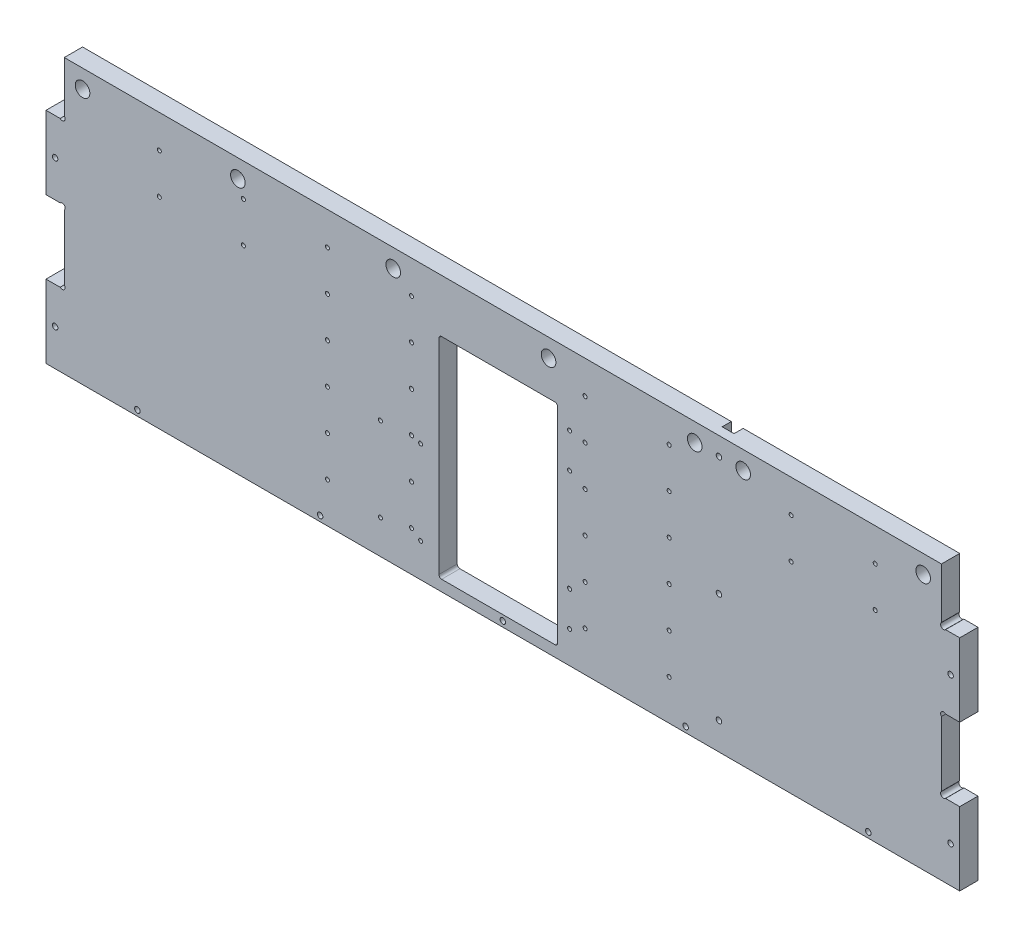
SolidWorks part; units mm, degrees
ref_plane "Plan de face" through (0, 0, 0) normal (0, 0, 1) x (1, 0, 0)
ref_plane "Plan de dessus" through (0, 0, 0) normal (0, 1, 0) x (1, 0, 0)
ref_plane "Plan de droite" through (0, 0, 0) normal (1, 0, 0) x (0, 0, -1)
sketch "Esquisse1" plane through (0, 0, 0) normal (0, 0, 1) x (1, 0, 0)
  line L0 (0, 0) -> (500, 0)
  line L2 (275, 0) -> (-275, 0) construction
  line L4 (0, -82.5) -> (0, 82.5) construction
  line L5 (500, 0) -> (500, 40)
  line L6 (500, 40) -> (490, 40)
  line L7 (490, 40) -> (490, 80)
  line L8 (490, 80) -> (500, 80)
  line L9 (500, 80) -> (500, 120)
  line L10 (500, 120) -> (490, 120)
  line L11 (490, 120) -> (490, 150)
  line L12 (490, 150) -> (10, 150)
  line L13 (10, 150) -> (10, 120)
  line L14 (10, 120) -> (0, 120)
  line L15 (0, 120) -> (0, 80)
  line L16 (0, 80) -> (10, 80)
  line L17 (10, 80) -> (10, 40)
  line L18 (10, 40) -> (0, 40)
  line L19 (0, 40) -> (0, 0)
  dimension "D1" = 40
  dimension "D2" = 10
  dimension "D3" = 500
  dimension "D4" = 150
extrude "Extrusion1" add sketch "Esquisse1" along normal blind 10
sketch "Esquisse2" plane through (0, 0, 10) normal (0, 0, 1) x (1, 0, 0)
  line L0 (250, 0) -> (250, 150) construction
  line L1 (0, 0) -> (500, 0) construction
  line L2 (490, 150) -> (10, 150) construction
  line L3 (10, 40) -> (-2.4055, 52.4055) construction
  line L4 (10, 40) -> (0, 40) construction
  line L5 (10, 80) -> (10, 40) construction
  line L6 (10, 80) -> (-2.4762, 67.5238) construction
  line L7 (0, 80) -> (10, 80) construction
  line L8 (10, 120) -> (-2.4762, 132.4762) construction
  line L9 (10, 120) -> (0, 120) construction
  line L10 (10, 150) -> (10, 120) construction
  line L11 (490, 40) -> (495.9282, 45.9282) construction
  line L12 (500, 40) -> (490, 40) construction
  circle A0 centre (8.8686, 121.1314) radius 1.6
  circle A1 centre (8.8686, 78.8686) radius 1.6
  circle A2 centre (8.8686, 41.1314) radius 1.6
  circle A3 centre (491.1314, 121.1314) radius 1.6
  circle A4 centre (491.1314, 78.8686) radius 1.6
  circle A5 centre (491.1314, 41.1314) radius 1.6
  dimension "D1" = 3.2
extrude "Enlèv. mat.-enfourchement" cut sketch "Esquisse2" against normal through all
sketch "Esquisse3" plane through (0, 0, 10) normal (0, 0, 1) x (1, 0, 0)
  line L0 (500, 3) -> (0, 3) construction
  line L3 (500, 0) -> (500, 40) construction
  line L4 (250, 0) -> (250, 150) construction
  line L5 (0, 0) -> (500, 0) construction
  line L6 (490, 150) -> (10, 150) construction
  line L7 (495, 120) -> (495, 0) construction
  line L8 (500, 120) -> (492.2627, 120) construction
  line L9 (500, 80) -> (500, 120) construction
  line L10 (0, 40) -> (0, 0) construction
  line L11 (5, 0) -> (5, 120) construction
  line L12 (7.7373, 120) -> (0, 120) construction
  line L13 (0, 120) -> (0, 80) construction
  line L14 (0, 100) -> (500, 100) construction
  line L15 (500, 20) -> (0, 20) construction
  line L16 (450, 0) -> (450, 34.5114) construction
  line L17 (350, 0) -> (350, 34.5114) construction
  line L18 (150, 0) -> (150, 34.5114) construction
  line L19 (50, 0) -> (50, 28.3814) construction
  circle A0 centre (5, 20) radius 1.5
  circle A1 centre (5, 100) radius 1.5
  circle A2 centre (495, 20) radius 1.5
  circle A3 centre (495, 100) radius 1.5
  circle A4 centre (250, 3) radius 1.5
  circle A5 centre (50, 3) radius 1.5
  circle A6 centre (150, 3) radius 1.5
  circle A7 centre (450, 3) radius 1.5
  circle A8 centre (350, 3) radius 1.5
  dimension "D8" = 3
  dimension "D1" = 5
  dimension "D2" = 3
  dimension "D3" = 5
  dimension "D4" = 100
  dimension "D5" = 100
  dimension "D6" = 100
  dimension "D7" = 100
extrude "Enlèv. mat.-fixation sol et murs" cut sketch "Esquisse3" against normal through all
sketch "Esquisse6" plane through (0, 0, 0) normal (0, 0, -1) x (-1, 0, 0)
  line L0 (-490, 150) -> (-10, 150) construction
  line L1 (-365, 150) -> (-371.5, 150)
  line L2 (-365, 150) -> (-365, 0)
  line L3 (-365, 0) -> (-371.5, 0)
  line L4 (-371.5, 150) -> (-371.5, 0)
  line L5 (0, 0) -> (-500, 0) construction
  line L6 (-490, 122.2627) -> (-490, 150) construction
  dimension "D1" = 125
  dimension "D2" = 6.5
sketch "Esquisse4" plane through (0, 0, 10) normal (0, 0, 1) x (1, 0, 0)
  line L0 (10, 140) -> (490, 140) construction
  line L1 (10, 150) -> (10, 122.2627) construction
  line L2 (490, 122.2627) -> (490, 150) construction
  line L3 (490, 150) -> (10, 150) construction
  circle A0 centre (480, 140) radius 4
  circle A1 centre (20, 140) radius 4
  dimension "D2" = 8
  dimension "D3" = 10
  dimension "D1" = 10
extrude "Enlèv. mat.-Extru.1" cut sketch "Esquisse4" against normal through all
extrude "Enlèv. mat.-Extru.4" cut sketch "Esquisse6" against normal blind 5
sketch "Esquisse9" plane through (0, 0, 5) normal (0, 0, -1) x (-1, 0, 0)
  line L0 (-368.25, 150) -> (-368.25, 0) construction
  line L1 (-365, 150) -> (-371.5, 150) construction
  line L2 (-371.5, 0) -> (-365, 0) construction
  line L3 (-480, 140) -> (-351.1251, 140) construction
  line L4 (-371.5, 75) -> (-365, 75) construction
  line L5 (-371.5, 150) -> (-371.5, 0) construction
  line L6 (-365, 0) -> (-365, 150) construction
  circle A0 centre (-368.25, 140) radius 1.5
  circle A1 centre (-368.25, 75) radius 1.5
  circle A2 centre (-368.25, 15) radius 1.5
  dimension "D1" = 3
  dimension "D2" = 15
extrude "Enlèv. mat.-Extru.5" cut sketch "Esquisse9" against normal through all
sketch "Esquisse10" plane through (0, 0, 0) normal (0, 0, -1) x (-1, 0, 0)
  line L0 (-480, 140) -> (-20, 140) construction
  line L1 (-371.5, 150) -> (-371.5, 0) construction
  line L2 (-365, 0) -> (-365, 150) construction
  circle A0 centre (-381.5, 140) radius 4
  circle A1 centre (-355, 140) radius 4
  circle A2 centre (-480, 140) radius 4 construction
  circle A3 centre (-190, 140) radius 4
  circle A4 centre (-105, 140) radius 4
  circle A5 centre (-275, 140) radius 4
  dimension "D2" = 10
  dimension "D3" = 85
  dimension "D4" = 85
  dimension "D1" = 10
  dimension "D5" = 85
extrude "Enlèv. mat.-Extru.6" cut sketch "Esquisse10" against normal through all
sketch "Esquisse12" plane through (0, 0, 0) normal (0, 0, -1) x (-1, 0, 0)
  line L1 (-280, 119.5) -> (-280, 7.5)
  line L2 (-278.5, 6) -> (-216.5, 6)
  line L3 (-278.5, 121) -> (-216.5, 121)
  line L4 (-215, 7.5) -> (-215, 119.5)
  line L6 (-500, 0) -> (-500, 40) construction
  line L7 (0, 0) -> (-365, 0) construction
  arc A0 (-278.5, 121) -> (-280, 119.5) centre (-278.5, 119.5) ccw
  arc A1 (-215, 119.5) -> (-216.5, 121) centre (-216.5, 119.5) ccw
  arc A2 (-216.5, 6) -> (-215, 7.5) centre (-216.5, 7.5) ccw
  arc A3 (-280, 7.5) -> (-278.5, 6) centre (-278.5, 7.5) ccw
  dimension "D5" = 1.5
  dimension "D1" = 220
  dimension "D2" = 65
  dimension "D3" = 115
  dimension "D4" = 6
extrude "Enlèv. mat.-Extru.7_porte" cut sketch "Esquisse12" against normal through all
sketch "Esquisse13" plane through (0, 0, 0) normal (0, 0, -1) x (-1, 0, 0)
  line L0 (-481.4029, 132) -> (-10, 132) construction
  line L1 (-365, 150) -> (-10, 150) construction
  line L2 (0, 110) -> (-481.4029, 110) construction
  line L3 (-341, 132) -> (-341, 0) construction
  line L4 (-295, 0) -> (-295, 132) construction
  line L5 (-200, 132) -> (-200, 0) construction
  line L6 (0, 0) -> (-365, 0) construction
  line L7 (-154, 132) -> (-154, 0) construction
  line L8 (-280, 119.5) -> (-280, 7.5) construction
  line L10 (-215, 7.5) -> (-215, 119.5) construction
  line L11 (-357.7682, 88) -> (-140.6639, 88) construction
  line L12 (-357.7682, 66) -> (-140.6639, 66) construction
  line L13 (-140.6639, 44) -> (-357.7682, 44) construction
  line L14 (-140.6639, 22) -> (-357.7682, 22) construction
  line L20 (-108, 132) -> (-108, 110) construction
  line L21 (-10, 150) -> (-10, 122.2627) construction
  line L22 (0, 120) -> (0, 80) construction
  line L23 (-62, 132) -> (-62, 110) construction
  line L24 (-430.75, 150) -> (-430.75, 0) construction
  line L25 (-490, 150) -> (-371.5, 150) construction
  line L26 (-371.5, 0) -> (-500, 0) construction
  line L27 (-407.75, 132) -> (-407.75, 110) construction
  line L28 (-453.75, 132) -> (-453.75, 110) construction
  circle A0 centre (-453.75, 132) radius 1.1
  circle A1 centre (-453.75, 110) radius 1.1
  circle A2 centre (-407.75, 110) radius 1.1
  circle A3 centre (-407.75, 132) radius 1.1
  circle A4 centre (-341, 132) radius 1.1
  circle A5 centre (-295, 132) radius 1.1
  circle A6 centre (-295, 110) radius 1.1
  circle A7 centre (-341, 110) radius 1.1
  circle A8 centre (-341, 88) radius 1.1
  circle A9 centre (-295, 88) radius 1.1
  circle A10 centre (-295, 66) radius 1.1
  circle A11 centre (-295, 44) radius 1.1
  circle A12 centre (-295, 22) radius 1.1
  circle A13 centre (-341, 22) radius 1.1
  circle A14 centre (-341, 44) radius 1.1
  circle A15 centre (-341, 66) radius 1.1
  circle A16 centre (-200, 132) radius 1.1
  circle A18 centre (-154, 132) radius 1.1
  circle A19 centre (-154, 110) radius 1.1
  circle A21 centre (-200, 110) radius 1.1
  circle A22 centre (-200, 88) radius 1.1
  circle A23 centre (-154, 88) radius 1.1
  circle A24 centre (-154, 66) radius 1.1
  circle A25 centre (-154, 44) radius 1.1
  circle A26 centre (-154, 22) radius 1.1
  circle A27 centre (-200, 22) radius 1.1
  circle A28 centre (-200, 44) radius 1.1
  circle A29 centre (-200, 66) radius 1.1
  circle A32 centre (-108, 110) radius 1.1
  circle A34 centre (-62, 110) radius 1.1
  circle A35 centre (-62, 132) radius 1.1
  circle A37 centre (-108, 132) radius 1.1
  dimension "D11" = 2.2
  dimension "D1" = 18
  dimension "D2" = 22
  dimension "D3" = 46
  dimension "D4" = 46
  dimension "D5" = 15
  dimension "D6" = 15
  dimension "D7" = 22
  dimension "D8" = 22
  dimension "D9" = 22
  dimension "D10" = 22
  dimension "D14" = 46
  dimension "D16" = 46
  dimension "D17" = 46
extrude "Enlèv. mat.-Extru.8_trame" cut sketch "Esquisse13" against normal through all
sketch "Esquisse14" plane through (0, 0, 0) normal (0, 0, -1) x (-1, 0, 0)
  line L0 (-286.5, 150) -> (-286.5, 0) construction
  line L1 (-365, 150) -> (-10, 150) construction
  line L2 (0, 0) -> (-365, 0) construction
  line L3 (-280, 119.5) -> (-280, 7.5) construction
  circle A0 centre (-286.5, 111.5) radius 1.1
  circle A1 centre (-286.5, 92.5) radius 1.1
  circle A2 centre (-286.5, 36.5) radius 1.1
  circle A3 centre (-286.5, 17.5) radius 1.1
  dimension "D2" = 38.5
  dimension "D3" = 19
  dimension "D4" = 56
  dimension "D5" = 19
  dimension "D6" = 2.2
  dimension "D1" = 6.5
extrude "Enlèv. mat.-Extru.7" cut sketch "Esquisse14" against normal through all
sketch "Esquisse15" plane through (0, 0, 0) normal (0, 0, -1) x (-1, 0, 0)
  line L0 (-223.0599, 41.5) -> (-178.9851, 41.5) construction
  line L1 (0, 0) -> (-365, 0) construction
  line L2 (-205, 18.5) -> (-205, 64.5) construction
  line L3 (-183, 18.5) -> (-183, 64.5) construction
  line L4 (-183, 64.5) -> (-205, 64.5) construction
  line L5 (-205, 18.5) -> (-183, 18.5) construction
  line L6 (-215, 7.5) -> (-215, 119.5) construction
  circle A0 centre (-205, 64.5) radius 1.1
  circle A1 centre (-183, 64.5) radius 1.1
  circle A2 centre (-183, 18.5) radius 1.1
  circle A3 centre (-205, 18.5) radius 1.1
  circle A4 centre (-200, 88) radius 1.1 construction
  dimension "D1" = 41.5
  dimension "D2" = 22
  dimension "D3" = 46
  dimension "D4" = 10
extrude "Enlèv. mat.-Extru.8" cut sketch "Esquisse15" against normal through all
